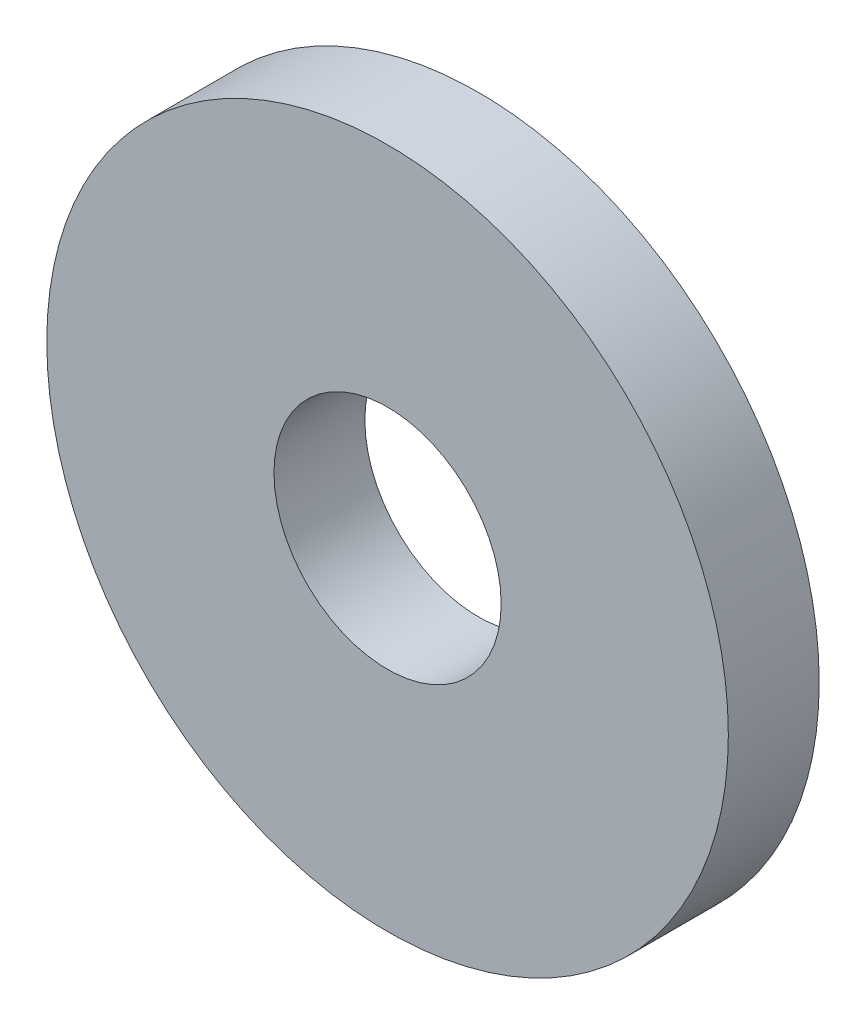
SolidWorks part; units mm, degrees
ref_plane "Front Plane" through (0, 0, 0) normal (0, 0, 1) x (1, 0, 0)
ref_plane "Top Plane" through (0, 0, 0) normal (0, 1, 0) x (1, 0, 0)
ref_plane "Right Plane" through (0, 0, 0) normal (1, 0, 0) x (0, 0, -1)
sketch "Sketch1" plane through (0, 0, 0) normal (0, 0, 1) x (1, 0, 0)
  circle A0 centre (0, 0) radius 3.175
  circle A1 centre (0, 0) radius 9.525
  dimension "D1" = 6.35
  dimension "D2" = 6.35
extrude "Boss-Extrude1" add sketch "Sketch1" along normal blind 2.54
